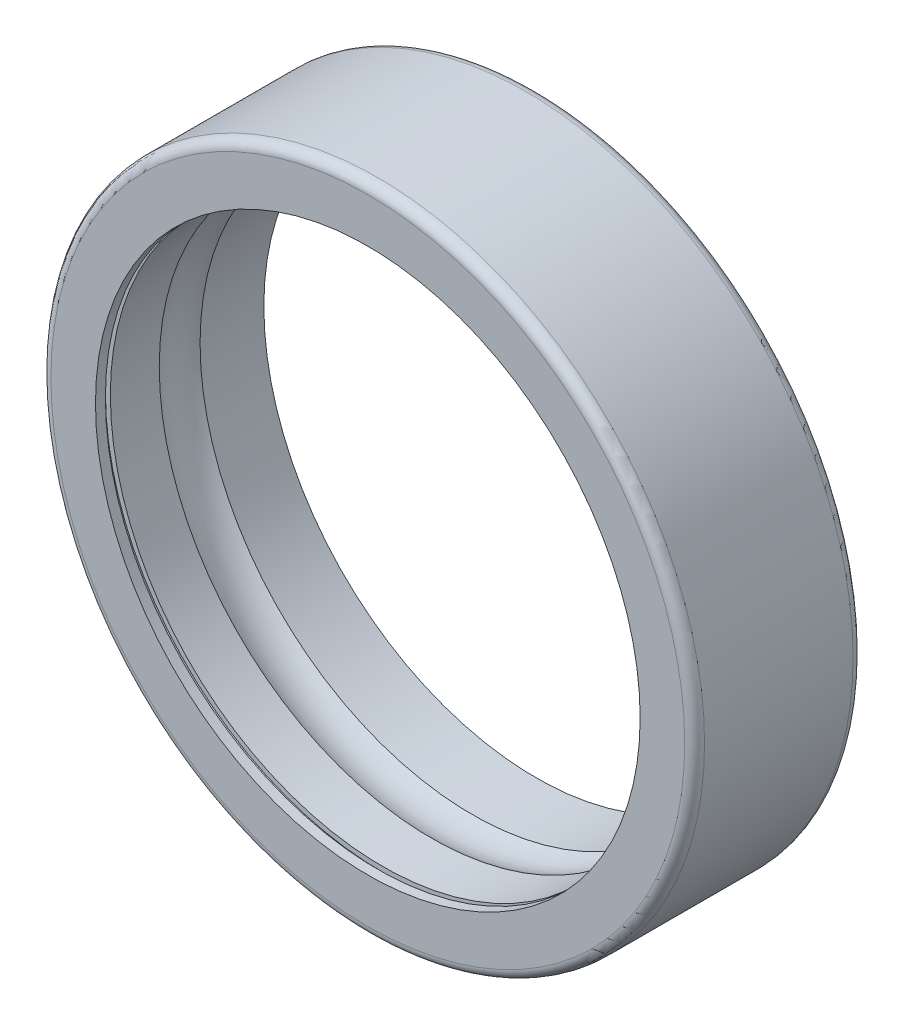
SolidWorks part; units mm, degrees
ref_plane "Plan1" through (0, 0, 0) normal (0, 0, 1) x (1, 0, 0)
ref_plane "Plan2" through (0, 0, 0) normal (0, 1, 0) x (1, 0, 0)
ref_plane "Plan3" through (0, 0, 0) normal (1, 0, 0) x (0, 0, -1)
sketch "Esquisse1" plane through (0, 0, 0) normal (1, 0, 0) x (0, 0, -1)
  line L0 (-3.75, 16.5) -> (3.75, 16.5)
  line L1 (-4.25, 16) -> (-4.25, 13.75)
  line L2 (4.25, 13.75) -> (1.0308, 13.75)
  line L3 (4.25, 13.75) -> (4.25, 16)
  line L4 (-1.0308, 13.75) -> (-3.5, 13.75)
  line L5 (0, 0) -> (-9, 0) construction
  line L6 (-3.75, 13.75) -> (-3.75, 14)
  line L7 (-3.75, 14) -> (-3.5, 14)
  line L8 (0, 6) -> (0, -2) construction
  line L9 (-3.5, 14) -> (-3.5, 13.75)
  line L10 (-3.75, 13.75) -> (-4.25, 13.75)
  arc A0 (1.0308, 13.75) -> (-1.0308, 13.75) centre (0, 11.75) ccw
  arc A1 (4.25, 16) -> (3.75, 16.5) centre (3.75, 16) ccw
  arc A2 (-4.25, 16) -> (-3.75, 16.5) centre (-3.75, 16) cw
  point P14 (4.25, 16.5)
  point P17 (-4.25, 16.5)
  dimension "D5" = 2.25
  dimension "D7" = 0.5
  dimension "D4" = 2
  dimension "D1" = 16.5
  dimension "D2" = 13.75
  dimension "D3" = 8.5
  dimension "D6" = 4.25
  dimension "D8" = 0.5
  dimension "D9" = 0.25
  dimension "D10" = 0.25
revolve "Base-Révolution" add sketch "Esquisse1" angle 360 about L5
